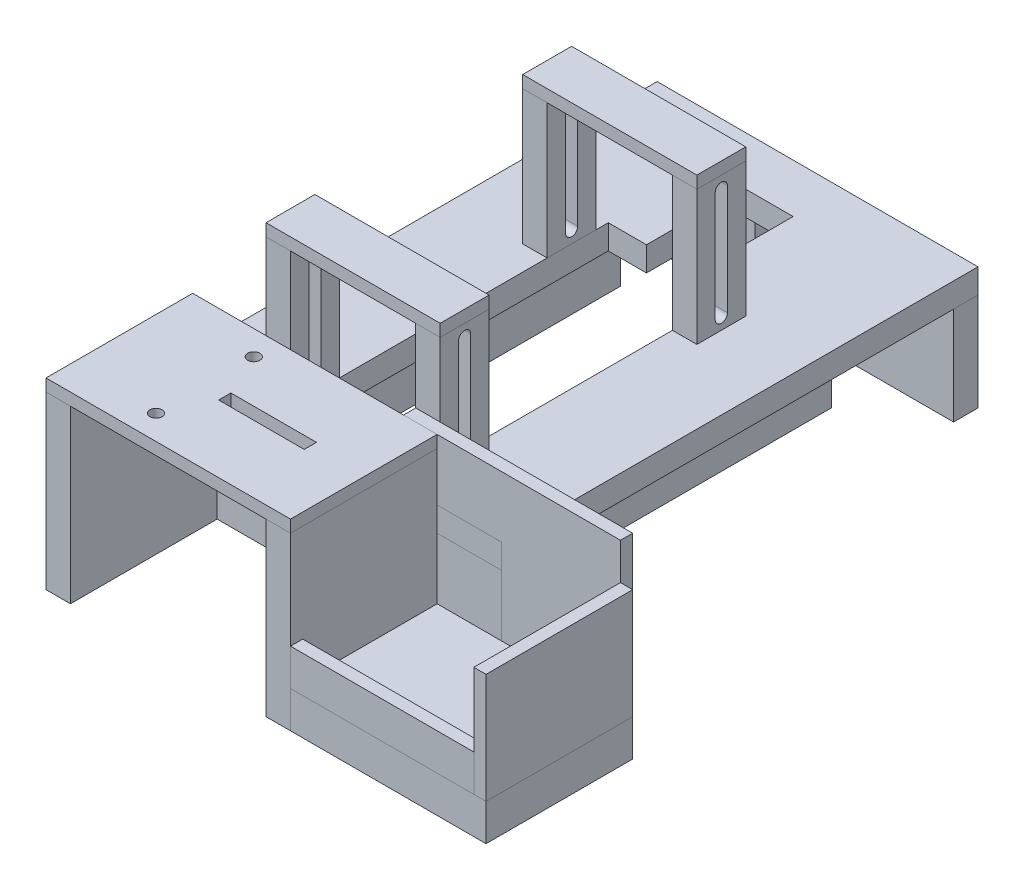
SolidWorks part; units mm, degrees
ref_plane "Front Plane" through (0, 0, 0) normal (0, 0, 1) x (1, 0, 0)
ref_plane "Top Plane" through (0, 0, 0) normal (0, 1, 0) x (1, 0, 0)
ref_plane "Right Plane" through (0, 0, 0) normal (1, 0, 0) x (0, 0, -1)
sketch "Sketch1" plane through (0, 0, 0) normal (0, 1, 0) x (1, 0, 0)
  line L0 (0, 0) -> (-50.8, 0)
  line L1 (65.0875, 171.45) -> (0, 171.45)
  line L2 (65.0875, 171.45) -> (65.0875, 0)
  line L3 (65.0875, 0) -> (0, 0) construction
  line L4 (0, 171.45) -> (0, 0)
  line L5 (-50.8, 247.65) -> (115.8875, 247.65)
  line L6 (-50.8, 247.65) -> (-50.8, 0)
  line L7 (65.0875, 0) -> (115.8875, 0)
  line L8 (115.8875, 247.65) -> (115.8875, 0)
  dimension "D1" = 65.0875
  dimension "D2" = 171.45
  dimension "D3" = 50.8
  dimension "D4" = 50.8
  dimension "D5" = 76.2
extrude "Boss-Extrude1" add sketch "Sketch1" along normal blind 12.7
sketch "Sketch2" plane through (0, 12.7, 0) normal (0, 1, 0) x (1, 0, 0)
  line L0 (0, 171.45) -> (65.0875, 171.45) construction
  line L1 (32.5437, 171.45) -> (32.5437, 222.25) construction
  line L3 (19.8437, 171.45) -> (45.2437, 171.45)
  line L4 (19.8437, 171.45) -> (19.8437, 222.25)
  line L5 (19.8437, 222.25) -> (45.2437, 222.25)
  line L6 (45.2437, 171.45) -> (45.2437, 222.25)
  dimension "D1" = 50.8
  dimension "D2" = 25.4
extrude "Cut-Extrude1" cut sketch "Sketch2" against normal blind 19.05
sketch "Sketch3" plane through (0, 0, 0) normal (0, -1, 0) x (1, 0, 0)
  line L0 (0, 0) -> (0, -171.45) construction
  line L1 (-31.75, 0) -> (0, 0)
  line L2 (-31.75, 0) -> (-31.75, -12.7)
  line L3 (-31.75, -12.7) -> (0, -12.7)
  line L4 (0, 0) -> (0, -12.7)
  line L5 (65.0875, 0) -> (115.8875, 0) construction
  line L6 (115.8875, 0) -> (77.7875, 0)
  line L7 (115.8875, 0) -> (115.8875, -12.7)
  line L8 (115.8875, -12.7) -> (77.7875, -12.7)
  line L9 (77.7875, 0) -> (77.7875, -12.7)
  line L10 (-50.8, -247.65) -> (-50.8, 0) construction
  line L11 (-50.8, -247.65) -> (12.7, -247.65)
  line L12 (-50.8, -247.65) -> (-50.8, -234.95)
  line L13 (-50.8, -234.95) -> (12.7, -234.95)
  line L14 (12.7, -247.65) -> (12.7, -234.95)
  line L15 (115.8875, -247.65) -> (52.3875, -247.65)
  line L16 (115.8875, -247.65) -> (115.8875, -234.95)
  line L17 (115.8875, -234.95) -> (52.3875, -234.95)
  line L18 (52.3875, -247.65) -> (52.3875, -234.95)
  line L21 (-50.8, 0) -> (0, 0) construction
  line L22 (65.0875, -171.45) -> (65.0875, 0) construction
  dimension "D1" = 12.7
  dimension "D2" = 12.7
  dimension "D3" = 63.5
  dimension "D4" = 63.5
  dimension "D5" = 19.05
  dimension "D6" = 12.7
  dimension "D8" = 12.7
extrude "Boss-Extrude2" add sketch "Sketch3" along normal blind 50.8 separate body
sketch "Sketch4" plane through (0, 0, 0) normal (0, -1, 0) x (1, 0, 0)
  line L1 (77.7875, -209.55) -> (65.0875, -209.55)
  line L2 (77.7875, -209.55) -> (77.7875, 0)
  line L3 (77.7875, 0) -> (65.0875, 0) construction
  line L4 (65.0875, -209.55) -> (65.0875, 0)
  line L6 (65.0875, 0) -> (115.8875, 0) construction
  line L9 (-31.75, 0) -> (-31.75, -12.7) construction
  line L10 (-44.45, -209.55) -> (-31.75, -209.55)
  line L11 (-44.45, -209.55) -> (-44.45, 76.2)
  line L12 (-44.45, 76.2) -> (-31.75, 76.2)
  line L13 (-31.75, -209.55) -> (-31.75, 76.2)
  line L14 (12.7, -234.95) -> (-50.8, -234.95) construction
  dimension "D1" = 12.7
  dimension "D2" = 12.7
  dimension "D3" = 25.4
extrude "Boss-Extrude3" add sketch "Sketch4" along normal blind 50.8 separate body contours L10 L13 M5 M6 | L13 L12 L11 M5 | L4 L1 M8 M9
sketch "Sketch5" plane through (0, 0, 0) normal (0, 1, 0) x (1, 0, 0)
  line L0 (-44.45, 209.55) -> (-44.45, -76.2) construction
  line L1 (-44.45, 0) -> (-31.75, 0)
  line L2 (-44.45, 0) -> (-44.45, -76.2)
  line L3 (-44.45, -76.2) -> (-31.75, -76.2)
  line L4 (-31.75, 0) -> (-31.75, -76.2)
extrude "Boss-Extrude4" add sketch "Sketch5" along normal blind 38.1
sketch "Sketch6" plane through (0, 38.1, 0) normal (0, 1, 0) x (1, 0, 0)
  line L1 (-44.45, -76.2) -> (82.55, -76.2)
  line L2 (-44.45, -76.2) -> (-44.45, 0)
  line L3 (-44.45, 0) -> (82.55, 0)
  line L4 (82.55, -76.2) -> (82.55, 0)
  dimension "D1" = 127
extrude "Boss-Extrude5" add sketch "Sketch6" along normal blind 6.35 separate body
sketch "Sketch7" plane through (0, 44.45, 0) normal (0, 1, 0) x (1, 0, 0)
  line L0 (0, -76.2) -> (65.0875, 0) construction
  line L1 (32.5437, -38.1) -> (54.7687, -38.1) construction
  line L2 (10.3187, -34.925) -> (54.7687, -34.925)
  line L3 (10.3187, -34.925) -> (10.3187, -41.275)
  line L4 (10.3187, -41.275) -> (54.7687, -41.275)
  line L5 (54.7687, -34.925) -> (54.7687, -41.275)
  line L7 (82.55, 0) -> (-44.45, 0) construction
  line L8 (0, 0) -> (0, -76.2) construction
  line L9 (-44.45, -76.2) -> (82.55, -76.2) construction
  line L10 (0, 0) -> (0, 171.45) construction
  line L11 (65.0875, 0) -> (65.0875, -76.2) construction
  line L12 (65.0875, 171.45) -> (65.0875, 0) construction
  circle A0 centre (0, -12.7) radius 3.175
  circle A1 centre (0, -63.5) radius 3.175
  dimension "D4" = 6.35
  dimension "D1" = 6.35
  dimension "D2" = 44.45
  dimension "D3" = 22.225
  dimension "D5" = 25.4
extrude "Cut-Extrude2" cut sketch "Sketch7" against normal blind 6.35
sketch "Sketch8" plane through (0, 12.7, 0) normal (0, 1, 0) x (1, 0, 0)
  line L0 (0, 0) -> (0, 171.45) construction
  line L1 (0, 139.7) -> (-12.7, 139.7)
  line L2 (0, 139.7) -> (0, 165.1)
  line L3 (0, 165.1) -> (-12.7, 165.1)
  line L4 (-12.7, 139.7) -> (-12.7, 165.1)
  line L5 (0, 152.4) -> (-12.7, 152.4) construction
  line L6 (0, 171.45) -> (19.8437, 171.45) construction
  line L7 (-12.7, 19.05) -> (0, 19.05) construction
  line L8 (0, 6.35) -> (-12.7, 6.35)
  line L9 (0, 6.35) -> (0, 31.75)
  line L10 (0, 31.75) -> (-12.7, 31.75)
  line L11 (-12.7, 6.35) -> (-12.7, 31.75)
  line L12 (-50.8, 0) -> (0, 0) construction
  line L13 (32.5437, 222.25) -> (32.5437, 119.5037) construction
  line L14 (45.2437, 222.25) -> (19.8437, 222.25) construction
  line L15 (77.7875, 6.35) -> (77.7875, 31.75)
  line L16 (65.0875, 31.75) -> (77.7875, 31.75)
  line L17 (65.0875, 6.35) -> (65.0875, 31.75)
  line L18 (65.0875, 6.35) -> (77.7875, 6.35)
  line L19 (77.7875, 139.7) -> (77.7875, 165.1)
  line L20 (65.0875, 165.1) -> (77.7875, 165.1)
  line L21 (65.0875, 139.7) -> (65.0875, 165.1)
  line L22 (65.0875, 139.7) -> (77.7875, 139.7)
  dimension "D1" = 12.7
  dimension "D2" = 19.05
  dimension "D3" = 25.4
  dimension "D4" = 25.4
  dimension "D5" = 19.05
  dimension "D6" = 12.7
extrude "Boss-Extrude6" add sketch "Sketch8" along normal blind 69.85 separate body
sketch "Sketch9" plane through (0, 82.55, 0) normal (0, 1, 0) x (1, 0, 0)
  line L1 (77.7875, 6.35) -> (-12.7, 6.35)
  line L2 (77.7875, 6.35) -> (77.7875, 31.75)
  line L3 (77.7875, 31.75) -> (-12.7, 31.75)
  line L4 (-12.7, 6.35) -> (-12.7, 31.75)
  line L5 (-12.7, 165.1) -> (77.7875, 165.1)
  line L6 (-12.7, 165.1) -> (-12.7, 139.7)
  line L7 (-12.7, 139.7) -> (77.7875, 139.7)
  line L8 (77.7875, 165.1) -> (77.7875, 139.7)
extrude "Boss-Extrude7" add sketch "Sketch9" along normal blind 6.35 separate body
sketch "Sketch10" plane through (-12.7, 0, 0) normal (-1, 0, 0) x (0, 0, 1)
  line L0 (-152.4, 76.2) -> (-152.4, 19.05) construction
  line L1 (-149.225, 76.2) -> (-149.225, 19.05)
  line L2 (-155.575, 76.2) -> (-155.575, 19.05)
  line L3 (-165.1, 82.55) -> (-139.7, 12.7) construction
  line L4 (-165.1, 12.7) -> (-139.7, 12.7) construction
  line L5 (-139.7, 82.55) -> (-31.75, 82.55) construction
  line L6 (-85.725, 82.55) -> (-85.725, 35.5613) construction
  line L7 (-19.05, 76.2) -> (-19.05, 19.05) construction
  line L8 (-22.225, 76.2) -> (-22.225, 19.05)
  line L9 (-15.875, 76.2) -> (-15.875, 19.05)
  arc A0 (-149.225, 76.2) -> (-155.575, 76.2) centre (-152.4, 76.2) ccw
  arc A1 (-155.575, 19.05) -> (-149.225, 19.05) centre (-152.4, 19.05) ccw
  arc A2 (-22.225, 76.2) -> (-15.875, 76.2) centre (-19.05, 76.2) cw
  arc A3 (-15.875, 19.05) -> (-22.225, 19.05) centre (-19.05, 19.05) cw
  point P2 (-152.4, 47.625)
  point P21 (-19.05, 47.625)
  dimension "D1" = 6.35
  dimension "D2" = 6.35
extrude "Cut-Extrude3" cut sketch "Sketch10" against normal blind 120.65
sketch "Sketch11" plane through (0, 38.1, 0) normal (0, -1, 0) x (1, 0, 0)
  line L0 (82.55, 0) -> (-44.45, 0) construction
  line L1 (82.55, 76.2) -> (69.85, 76.2)
  line L2 (82.55, 76.2) -> (82.55, 0)
  line L3 (82.55, 0) -> (69.85, 0)
  line L4 (69.85, 76.2) -> (69.85, 0)
  dimension "D1" = 12.7
extrude "Boss-Extrude8" add sketch "Sketch11" along normal blind 88.9 separate body
sketch "Sketch12" plane through (0, -50.8, 0) normal (0, -1, 0) x (1, 0, 0)
  line L2 (82.55, 0) -> (184.15, 0)
  line L3 (82.55, 0) -> (82.55, 76.2)
  line L4 (82.55, 76.2) -> (184.15, 76.2)
  line L5 (184.15, 0) -> (184.15, 76.2)
  dimension "D1" = 101.6
extrude "Boss-Extrude9" add sketch "Sketch12" against normal blind 19.05 separate body
sketch "Sketch13" plane through (0, -31.75, 0) normal (0, 1, 0) x (1, 0, 0)
  line L0 (82.55, 0) -> (184.15, 0) construction
  line L1 (184.15, -76.2) -> (177.8, -76.2)
  line L2 (184.15, -76.2) -> (184.15, 0)
  line L3 (184.15, 0) -> (177.8, 0)
  line L4 (177.8, -76.2) -> (177.8, 0)
  dimension "D1" = 6.35
extrude "Boss-Extrude10" add sketch "Sketch13" along normal blind 57.15 separate body
sketch "Sketch14" plane through (0, 0, 0) normal (0, 0, -1) x (-1, 0, 0)
  line L0 (-115.8875, -50.8) -> (-177.8, -50.8)
  line L1 (-82.55, -50.8) -> (-184.15, -50.8) construction
  line L2 (-177.8, -50.8) -> (-177.8, 44.45)
  line L3 (-177.8, 44.45) -> (-65.0875, 44.45)
  line L4 (-82.55, 44.45) -> (44.45, 44.45) construction
  line L5 (-65.0875, 44.45) -> (-65.0875, 12.7)
  line L6 (-65.0875, 12.7) -> (-115.8875, 12.7)
  line L7 (-115.8875, -50.8) -> (-115.8875, 12.7)
extrude "Boss-Extrude11" add sketch "Sketch14" along normal blind 6.35 separate body
sketch "Sketch15" plane through (0, -31.75, 0) normal (0, 1, 0) x (1, 0, 0)
  line L1 (177.8, -76.2) -> (82.55, -76.2)
  line L2 (177.8, -76.2) -> (177.8, -69.85)
  line L3 (177.8, -69.85) -> (82.55, -69.85)
  line L4 (82.55, -76.2) -> (82.55, -69.85)
  dimension "D1" = 6.35
extrude "Boss-Extrude12" add sketch "Sketch15" along normal blind 19.05 separate body
